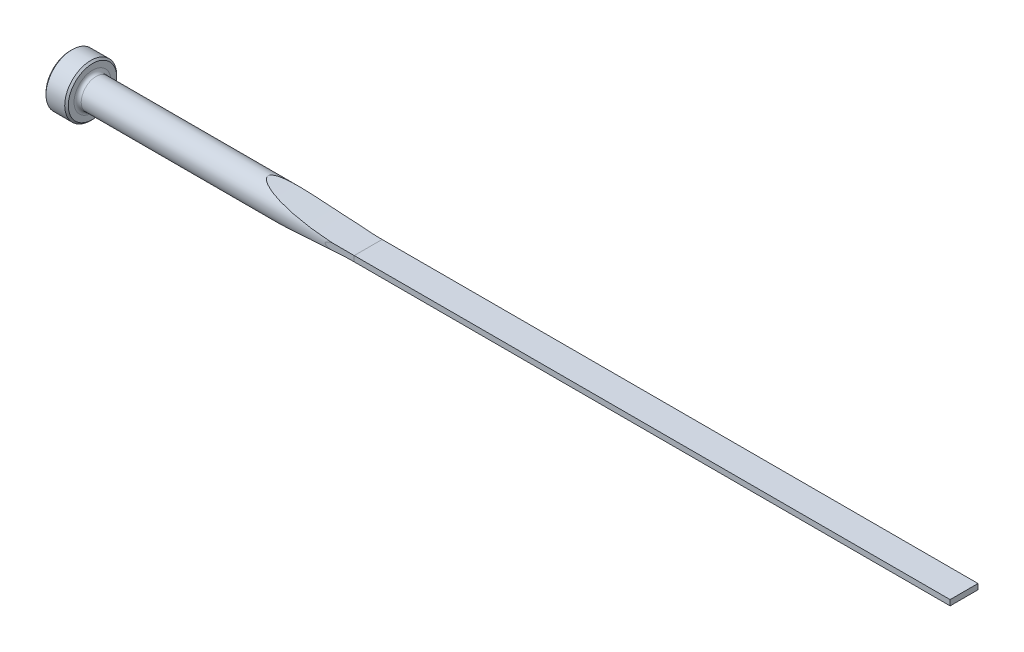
SolidWorks part; units mm, degrees
ref_plane "Front Plane" through (0, 0, 0) normal (0, 0, 1) x (1, 0, 0)
ref_plane "Top Plane" through (0, 0, 0) normal (0, 1, 0) x (1, 0, 0)
ref_plane "Right Plane" through (0, 0, 0) normal (1, 0, 0) x (0, 0, -1)
sketch "Sketch1" plane through (0, 0, 0) normal (0, 0, 1) x (1, 0, 0)
  line L0 (0, 0) -> (175.5286, 0) construction
  line L1 (0, 0) -> (0, 5.5499)
  line L2 (0, 5.5499) -> (4.7498, 5.5499)
  line L3 (4.7498, 5.5499) -> (4.7498, 3.175)
  line L4 (4.7498, 3.175) -> (190.5, 3.175)
  line L5 (190.5, 3.175) -> (190.5, 0)
  line L6 (190.5, 0) -> (0, 0)
  dimension "D1" = 190.5
  dimension "D2" = 11.0998
  dimension "D3" = 6.35
  dimension "D4" = 4.7498
revolve "Revolve1" add sketch "Sketch1" angle 360 about L0
sketch "Sketch2" plane through (0, 0, 0) normal (0, 0, 1) x (1, 0, 0)
  line L0 (190.5, 3.175) -> (190.5, 0.5842)
  line L1 (190.5, -3.175) -> (190.5, 3.175) construction
  line L2 (190.5, 0.5842) -> (63.5, 0.5842)
  line L3 (190.5, 3.175) -> (4.7498, 3.175) construction
  line L4 (42.1943, 3.175) -> (190.5, 3.175)
  line L5 (166.0833, 0) -> (153.1705, 0) construction
  arc A0 (63.5, 0.5842) -> (42.1943, 3.175) centre (63.5, 89.4842) cw
  dimension "D1" = 88.9
  dimension "D3" = 127
  dimension "D2" = 1.1684
  dimension "D4" = 21.3057
extrude "Cut-Extrude1" cut sketch "Sketch2" against normal through all both and the other way through all
mirror "Mirror1" about plane through (0, 0, 0) normal (0, 1, 0) of "Cut-Extrude1"
sketch "Sketch3" plane through (0, 0, 0) normal (0, 1, 0) x (1, 0, 0)
  line L0 (190.5, 3.175) -> (190.5, 2.9718)
  line L1 (190.5, 3.1208) -> (190.5, -3.1208) construction
  line L2 (190.5, 2.9718) -> (63.5, 2.9718)
  line L3 (190.5, 3.175) -> (4.7498, 3.175) construction
  line L4 (57.4927, 3.175) -> (190.5, 3.175)
  line L5 (163.4716, 0) -> (166.2513, 0) construction
  line L6 (63.5, 3.1208) -> (63.5, -3.1208) construction
  arc A0 (63.5, 2.9718) -> (57.4927, 3.175) centre (63.5, 91.8718) cw
  dimension "D2" = 88.9
  dimension "D1" = 5.9436
extrude "Cut-Extrude2" cut sketch "Sketch3" against normal through all both and the other way through all
mirror "Mirror2" about plane through (0, 0, 0) normal (0, 0, 1) of "Cut-Extrude2"
fillet "Fillet1" radius 0.762 1 edges at (4.7498, 0, 3.175)
chamfer "Chamfer1" distance 0.381 angle 45 2 edges at (0, 0, 5.5499) (4.7498, 0, 5.5499)
